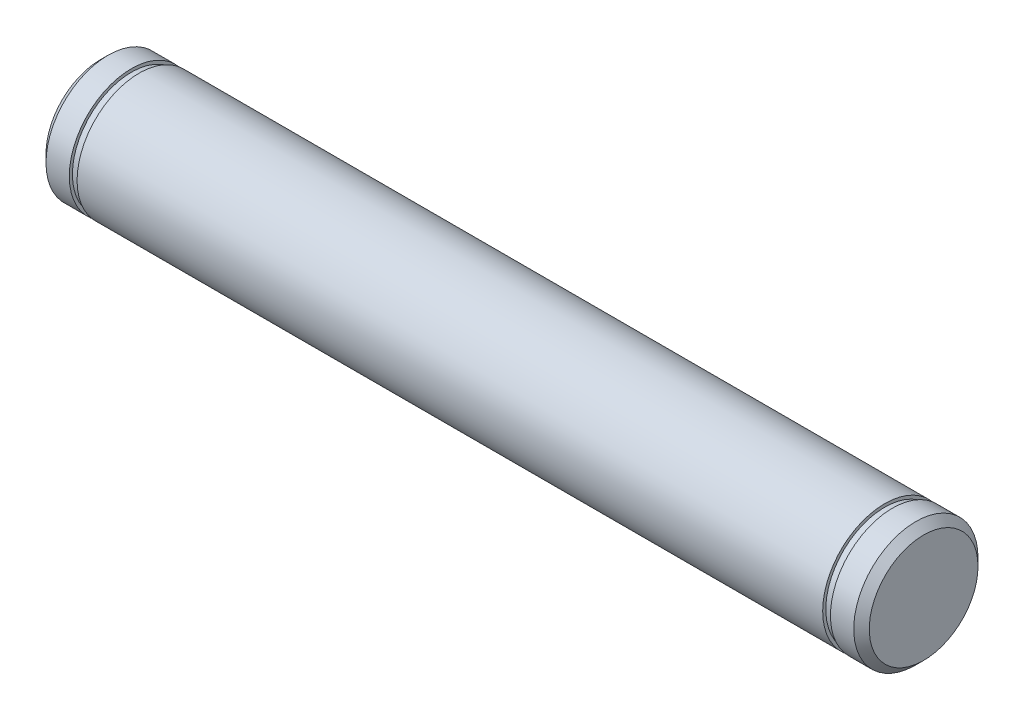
SolidWorks part; units mm, degrees
ref_plane "Front" through (0, 0, 0) normal (0, 0, 1) x (1, 0, 0)
ref_plane "Top" through (0, 0, 0) normal (0, 1, 0) x (1, 0, 0)
ref_plane "Right" through (0, 0, 0) normal (1, 0, 0) x (0, 0, -1)
sketch "Sketch1" plane through (0, 0, 0) normal (1, 0, 0) x (0, 0, -1)
  circle A0 centre (0, 0) radius 2
  dimension "D1" = 4
extrude "Boss-Extrude1" add sketch "Sketch1" along normal blind 26.5
sketch "Sketch2" plane through (26.5, 0, 0) normal (1, 0, 0) x (0, 0, -1)
  circle A0 centre (0, 0) radius 1.9
  circle A1 centre (0, 0) radius 2.4981
  dimension "D1" = 3.8
extrude "Cut-Extrude2" cut sketch "Sketch2" against normal blind 0.25 from offset 1
sketch "Sketch3" plane through (0, 0, 0) normal (-1, 0, 0) x (0, 0, 1)
  circle A0 centre (0, 0) radius 1.9
  circle A1 centre (0, 0) radius 2.5
extrude "Cut-Extrude3" cut sketch "Sketch3" against normal blind 0.25 from offset 1
chamfer "Chamfer1" distance 0.25 angle 45 2 edges at (0, 0, -2) (26.5, 0, -2)
